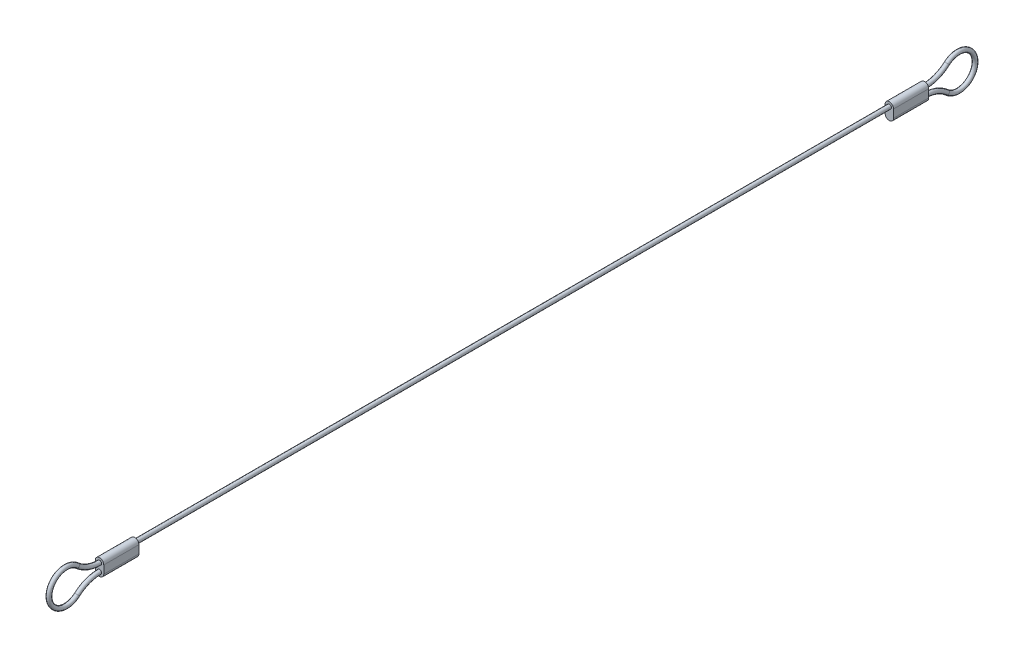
SolidWorks part; units mm, degrees
ref_plane "Front Plane" through (0, 0, 0) normal (0, 0, 1) x (1, 0, 0)
ref_plane "Top Plane" through (0, 0, 0) normal (0, 1, 0) x (1, 0, 0)
ref_plane "Right Plane" through (0, 0, 0) normal (1, 0, 0) x (0, 0, -1)
sketch "Sketch1" plane through (0, 0, 0) normal (1, 0, 0) x (0, 0, -1)
  line L0 (117.4, 0) -> (-117.4, 0)
  line L1 (0, 1.32) -> (0, -1.32) construction
  arc A0 (-117.4, 0) -> (-123.8, 2.4446) centre (-117.4, 9.6) cw
  arc A1 (-123.8, 2.4446) -> (-123.8, -4.7108) centre (-127, -1.1331) ccw
  arc A2 (-123.8, -4.7108) -> (-117.4, -2.2663) centre (-117.4, -11.8663) cw
  arc A3 (123.8, -4.7108) -> (117.4, -2.2663) centre (117.4, -11.8663) ccw
  arc A4 (123.8, 2.4446) -> (123.8, -4.7108) centre (127, -1.1331) cw
  arc A5 (117.4, 0) -> (123.8, 2.4446) centre (117.4, 9.6) ccw
  point P18 (0, 0)
  dimension "D1" = 4.8
  dimension "D4" = 9.6
  dimension "D2" = 127
  dimension "D3" = 9.6
sketch "Sketch2" plane through (0, 0, 0) normal (0, 0, 1) x (1, 0, 0)
  circle A0 centre (0, 0) radius 0.595
  dimension "D1" = 1.19
sweep "Sweep1" add profiles "Sketch2" path "Sketch1"
sketch "Sketch3" plane through (0, 0, 117.4) normal (0, 0, -1) x (-1, 0, 0)
  line L0 (0, 0) -> (0, -2.2663) construction
  line L1 (1.2, 0) -> (1.2, -2.2663)
  line L2 (-1.2, 0) -> (-1.2, -2.2663)
  line L3 (-0.595, -2.2663) -> (0.595, -2.2663) construction
  arc A0 (1.2, 0) -> (-1.2, 0) centre (0, 0) ccw
  arc A1 (-1.2, -2.2663) -> (1.2, -2.2663) centre (0, -2.2663) ccw
  point P3 (0, -1.1331)
  dimension "D1" = 2.4
extrude "Boss-Extrude1" add sketch "Sketch3" along normal blind 10
mirror "Mirror1" about plane through (0, 0, 0) normal (0, 0, 1) of "Boss-Extrude1"
